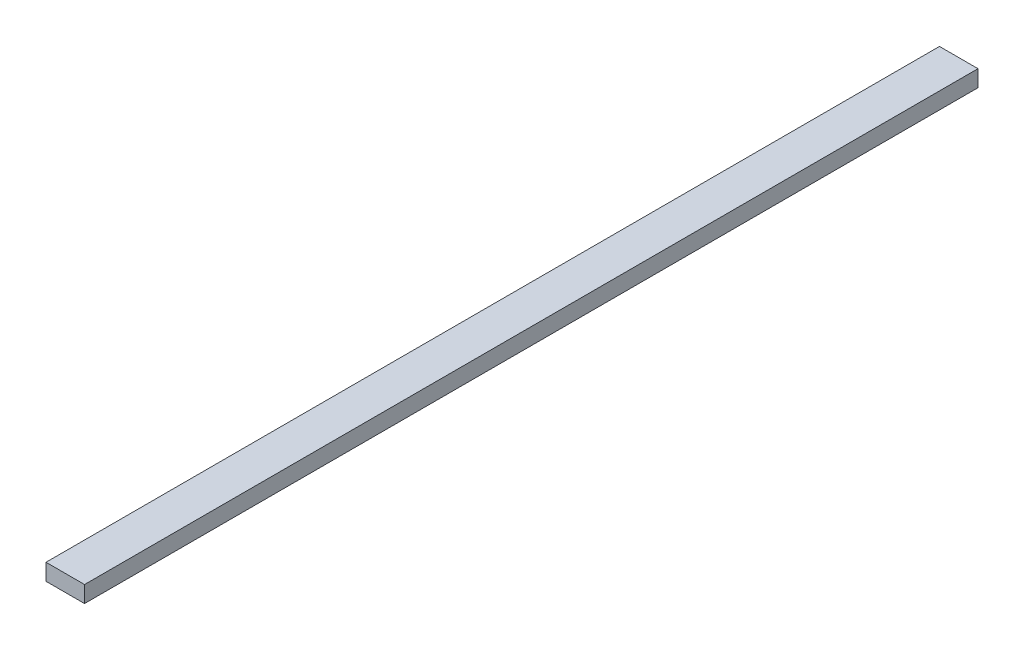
SolidWorks part; units mm, degrees
ref_plane "Front Plane" through (0, 0, 0) normal (0, 0, 1) x (1, 0, 0)
ref_plane "Top Plane" through (0, 0, 0) normal (0, 1, 0) x (1, 0, 0)
ref_plane "Right Plane" through (0, 0, 0) normal (1, 0, 0) x (0, 0, -1)
sketch "Sketch1" plane through (0, 0, 0) normal (0, 1, 0) x (1, 0, 0)
  line L0 (0, 0) -> (0, -2060.575)
  line L1 (0, -2060.575) -> (-88.9, -2060.575)
  line L2 (-88.9, -2060.575) -> (-88.9, 0)
  line L3 (-88.9, 0) -> (0, 0)
  dimension "D1" = 2060.575
  dimension "D3" = 88.9
extrude "Boss-Extrude1" add sketch "Sketch1" along normal blind 38.1
